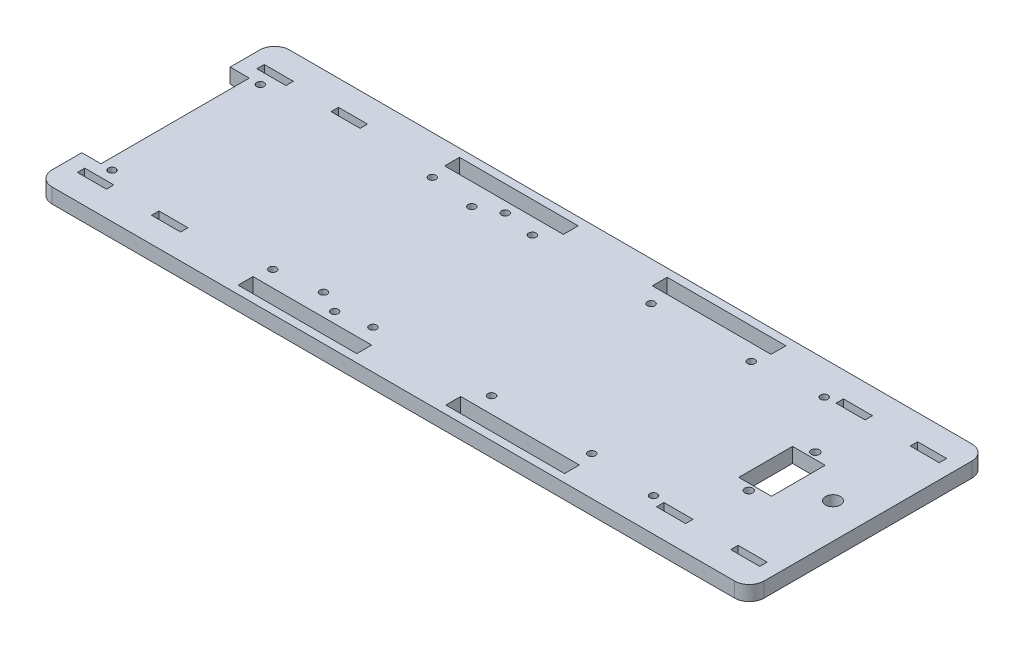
SolidWorks part; units mm, degrees
ref_plane "Front" through (0, 0, 0) normal (0, 0, 1) x (1, 0, 0)
ref_plane "Top" through (0, 0, 0) normal (0, 1, 0) x (1, 0, 0)
ref_plane "Right" through (0, 0, 0) normal (1, 0, 0) x (0, 0, -1)
sketch "Sketch1" plane through (0, 0, 0) normal (0, 1, 0) x (1, 0, 0)
  line L0 (-146.05, 0) -> (146.05, 0)
  line L1 (-152.4, 6.35) -> (-152.4, 19.05)
  line L2 (-146.05, 101.6) -> (146.05, 101.6)
  line L3 (-63.0907, 101.6) -> (-63.0907, 0) construction
  line L4 (-39.4335, 87.3125) -> (-39.4335, 14.2875) construction
  line L5 (-39.4335, 14.2875) -> (97.0915, 14.2875) construction
  line L6 (97.0915, 14.2875) -> (97.0915, 87.3125) construction
  line L7 (97.0915, 87.3125) -> (-39.4335, 87.3125) construction
  line L8 (-139.446, 82.55) -> (-139.446, 19.05) construction
  line L9 (-139.446, 19.05) -> (-48.9585, 19.05) construction
  line L10 (-48.9585, 19.05) -> (-48.9585, 82.55) construction
  line L11 (-48.9585, 82.55) -> (-139.446, 82.55) construction
  line L12 (-25.4, 84.9313) -> (-68.2625, 84.9312) construction
  line L13 (-68.2625, 84.9312) -> (-68.2625, 16.6687) construction
  line L14 (-68.2625, 16.6687) -> (-25.4, 16.6687) construction
  line L15 (-25.4, 16.6687) -> (-25.4, 84.9313) construction
  line L16 (-781.0819, 50.8) -> (49218.9181, 50.8) construction
  line L17 (-19.05, 3.429) -> (-19.05, 9.779)
  line L18 (108.5673, 62.3) -> (122.5673, 62.3)
  line L19 (108.5673, 62.3) -> (108.5673, 39.3)
  line L20 (108.5673, 39.3) -> (122.5673, 39.3)
  line L21 (0, -1000) -> (0, 49000) construction
  line L22 (122.5673, 62.3) -> (122.5673, 39.3)
  line L23 (-69.85, 98.171) -> (-19.05, 98.171)
  line L24 (-69.85, 98.171) -> (-69.85, 91.821)
  line L25 (-69.85, 91.821) -> (-19.05, 91.821)
  line L26 (-152.4, 82.55) -> (-152.4, 95.25)
  line L27 (-152.4, 82.55) -> (-144.2085, 82.55)
  line L28 (-152.4, 19.05) -> (-144.2085, 19.05)
  line L29 (-144.2085, 82.55) -> (-144.2085, 19.05)
  line L30 (152.4, 6.35) -> (152.4, 95.25)
  line L31 (-19.05, 98.171) -> (-19.05, 91.821)
  line L32 (-69.85, 3.429) -> (-19.05, 3.429)
  line L33 (-69.85, 3.429) -> (-69.85, 9.779)
  line L34 (-69.85, 9.779) -> (-19.05, 9.779)
  line L35 (19.05, 98.171) -> (19.05, 91.821)
  line L36 (69.85, 91.821) -> (19.05, 91.821)
  line L37 (69.85, 98.171) -> (69.85, 91.821)
  line L38 (69.85, 98.171) -> (19.05, 98.171)
  line L39 (69.85, 9.779) -> (19.05, 9.779)
  line L40 (69.85, 3.429) -> (69.85, 9.779)
  line L41 (69.85, 3.429) -> (19.05, 3.429)
  line L42 (19.05, 3.429) -> (19.05, 9.779)
  line L43 (115.5673, 62.3) -> (115.5673, 39.3) construction
  line L47 (-146.05, 87.63) -> (-146.05, 90.805)
  line L48 (-146.05, 87.63) -> (-133.604, 87.63)
  line L49 (-133.604, 87.63) -> (-133.604, 90.805)
  line L107 (-146.05, 90.805) -> (-133.604, 90.805)
  line L108 (-101.854, 90.805) -> (-114.3, 90.805)
  line L109 (-114.3, 87.63) -> (-114.3, 90.805)
  line L110 (-101.854, 87.63) -> (-114.3, 87.63)
  line L111 (-101.854, 87.63) -> (-101.854, 90.805)
  line L112 (-133.604, 89.2175) -> (-114.3, 89.2175) construction
  line L113 (-101.854, 13.97) -> (-101.854, 10.795)
  line L114 (-101.854, 13.97) -> (-114.3, 13.97)
  line L115 (-114.3, 13.97) -> (-114.3, 10.795)
  line L116 (-101.854, 10.795) -> (-114.3, 10.795)
  line L117 (-146.05, 10.795) -> (-133.604, 10.795)
  line L118 (-133.604, 13.97) -> (-133.604, 10.795)
  line L119 (-146.05, 13.97) -> (-133.604, 13.97)
  line L120 (-146.05, 13.97) -> (-146.05, 10.795)
  line L121 (101.854, 87.63) -> (101.854, 90.805)
  line L122 (101.854, 87.63) -> (114.3, 87.63)
  line L123 (114.3, 87.63) -> (114.3, 90.805)
  line L124 (101.854, 90.805) -> (114.3, 90.805)
  line L125 (146.05, 90.805) -> (133.604, 90.805)
  line L126 (133.604, 87.63) -> (133.604, 90.805)
  line L127 (146.05, 87.63) -> (133.604, 87.63)
  line L128 (146.05, 87.63) -> (146.05, 90.805)
  line L129 (101.854, 10.795) -> (114.3, 10.795)
  line L130 (114.3, 13.97) -> (114.3, 10.795)
  line L131 (101.854, 13.97) -> (114.3, 13.97)
  line L132 (101.854, 13.97) -> (101.854, 10.795)
  line L133 (146.05, 13.97) -> (146.05, 10.795)
  line L134 (146.05, 13.97) -> (133.604, 13.97)
  line L135 (133.604, 13.97) -> (133.604, 10.795)
  line L136 (146.05, 10.795) -> (133.604, 10.795)
  arc A0 (146.05, 101.6) -> (152.4, 95.25) centre (146.05, 95.25) cw
  circle A1 centre (-139.446, 19.05) radius 1.5875
  arc A2 (-152.4, 95.25) -> (-146.05, 101.6) centre (-146.05, 95.25) cw
  circle A3 centre (-39.4335, 14.2875) radius 1.5875
  circle A4 centre (97.0915, 14.2875) radius 1.5875
  circle A5 centre (-39.4335, 87.3125) radius 1.5875
  circle A6 centre (97.0915, 87.3125) radius 1.5875
  circle A7 centre (-48.9585, 19.05) radius 1.5875
  circle A8 centre (-139.446, 82.55) radius 1.5875
  arc A9 (-146.05, 0) -> (-152.4, 6.35) centre (-146.05, 6.35) cw
  circle A10 centre (-48.9585, 82.55) radius 1.5875
  circle A11 centre (-68.2625, 84.9312) radius 1.5875
  circle A12 centre (-68.2625, 16.6687) radius 1.5875
  circle A13 centre (-25.4, 84.9313) radius 1.5875
  circle A14 centre (-25.4, 16.6687) radius 1.5875
  circle A15 centre (68.2625, 16.6688) radius 1.5875
  circle A16 centre (25.4, 16.6687) radius 1.5875
  circle A17 centre (25.4, 84.9313) radius 1.5875
  circle A18 centre (68.2625, 84.9313) radius 1.5875
  circle A19 centre (137.3821, 50.8) radius 3.175
  circle A20 centre (115.5673, 65.05) radius 1.75
  arc A21 (146.05, 0) -> (152.4, 6.35) centre (146.05, 6.35) ccw
  circle A22 centre (115.5673, 36.55) radius 1.75
  point P10 (-63.0907, 50.8)
  point P20 (97.0915, 50.8)
  point P29 (-48.9585, 50.8)
  point P31 (-152.4, 0)
  point P32 (0, 0)
  point P42 (-25.4, 50.8)
  point P58 (108.5673, 50.8)
  point P59 (-144.2085, 50.8)
  point P125 (-123.952, 89.2175)
  dimension "D8" = 73.66
  dimension "D9" = 3.175
  dimension "D11" = 4.7625
  dimension "D12" = 73.025
  dimension "D13" = 90.4875
  dimension "D15" = 9.525
  dimension "D16" = 3.175
  dimension "D21" = 6.35
  dimension "D23" = 23
  dimension "D24" = 4.7625
  dimension "D25" = 63.5
  dimension "D26" = 6.35
  dimension "D6" = 19.304
  dimension "D10" = 136.525
  dimension "D3" = 6.35
  dimension "D31" = 3.5
  dimension "D32" = 28.5
  dimension "D4" = 101.6
  dimension "D5" = 12.446
  dimension "D7" = 3.175
  dimension "D14" = 63.5
  dimension "D17" = 68.2625
  dimension "D18" = 6.35
  dimension "D19" = 42.8625
  dimension "D20" = 25.4
  dimension "D22" = 14
  dimension "D27" = 6.35
  dimension "D28" = 3.429
  dimension "D29" = 50.8
  dimension "D30" = 19.05
extrude "Extrude1" add sketch "Sketch1" along normal blind 6.35
